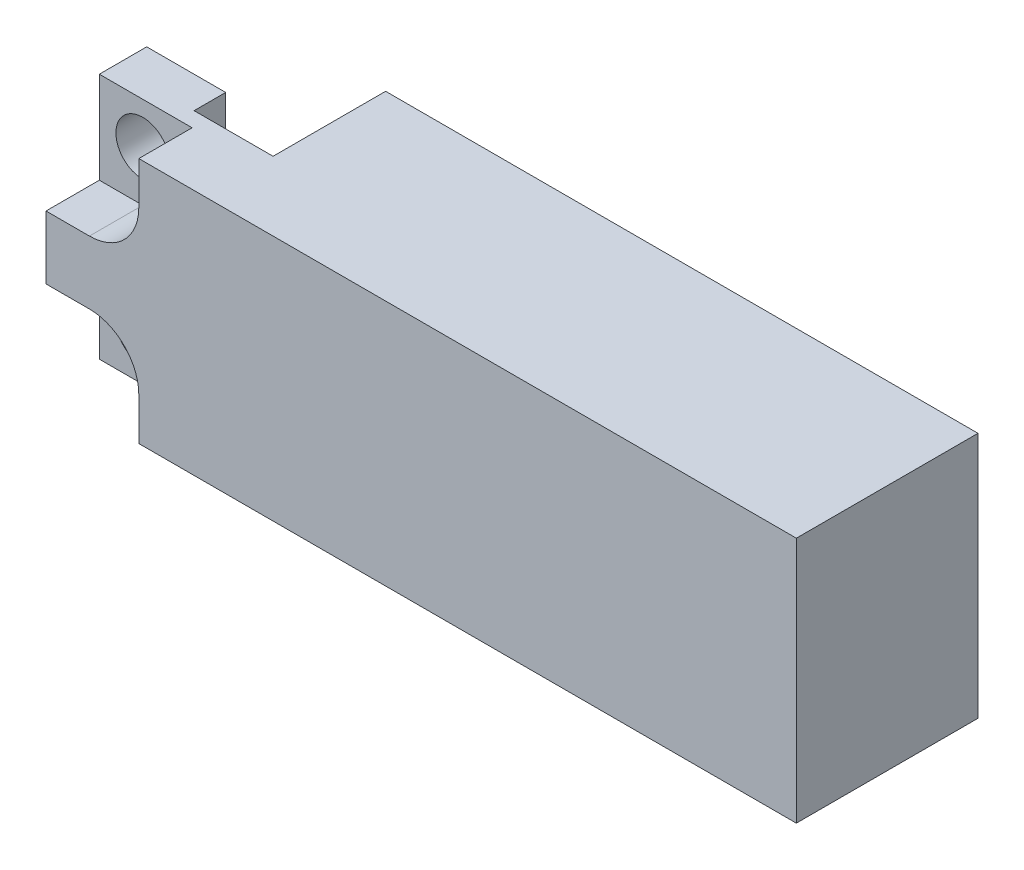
SolidWorks part; units mm, degrees
ref_plane "TOP" through (0, 0, 0) normal (0, 0, 1) x (1, 0, 0)
ref_plane "FRONT" through (0, 0, 0) normal (0, 1, 0) x (1, 0, 0)
ref_plane "RIGHT" through (0, 0, 0) normal (1, 0, 0) x (0, 0, -1)
sketch "Sketch1" plane through (0, 0, 0) normal (0, 1, 0) x (1, 0, 0)
  line L0 (-10.16, 6.477) -> (-10.16, 0)
  line L1 (-10.16, 6.477) -> (-5.08, 6.477)
  line L2 (-5.08, 6.477) -> (-5.08, 4.445)
  line L3 (-5.08, 4.445) -> (0, 4.445)
  line L4 (0, 4.445) -> (0, 11.684)
  line L5 (0, 11.684) -> (38.1, 11.684)
  line L6 (38.1, 11.684) -> (38.1, 0)
  line L7 (-10.16, 0) -> (38.1, 0)
  dimension "D1" = 7.239
  dimension "D2" = 5.08
  dimension "D3" = 5.08
  dimension "D4" = 11.684
  dimension "D5" = 2.032
  dimension "D6" = 38.1
  dimension "D7" = 48.26
extrude "Extrude1" add sketch "Sketch1" along normal mid plane 15.875
sketch "Sketch2" plane through (0, 0, 0) normal (0, 0, 1) x (1, 0, 0)
  line L0 (-10.16, 7.9375) -> (-10.16, -7.9375) construction
  point P0 (-7.366, 5.207)
  dimension "D1" = 2.794
  dimension "D2" = 5.207
hole_wizard "CBORE for #5 Socket Head Cap Screw1" positions "3DSketch1" profile "Sketch3" counterbore size "#5" standard "Ansi Inch"
sketch3d "3DSketch1"
  point P0 (-7.366, 5.207, 0)
sketch "Sketch3" plane through (-7.366, 5.207, 0) normal (1, 0, 0) x (0, -1, 0)
  line L0 (0, 0) -> (0, 11.684)
  line L1 (0, 11.684) -> (1.7272, 11.684)
  line L3 (1.7272, 11.684) -> (1.7272, 3.429)
  line L4 (1.7272, 3.429) -> (3.175, 3.429)
  line L5 (3.175, 3.429) -> (3.175, 0)
  line L7 (3.175, 0) -> (0, 0)
  line L11 (0, -6.35) -> (0, 107.95) construction
  dimension "Thru Hole Dia." = 3.4544
  dimension "Thru Hole Depth" = 11.684
  dimension "C'Bore Dia." = 6.35
  dimension "C'Bore Depth" = 3.429
sketch "Sketch4" plane through (0, 0, 0) normal (0, 0, 1) x (1, 0, 0)
  line L0 (-4.191, 5.207) -> (-4.191, 7.9375)
  line L2 (-5.7458, 7.9375) -> (38.1, 7.9375) construction
  line L3 (-4.191, 7.9375) -> (-10.16, 7.9375)
  line L4 (-10.16, 7.9375) -> (-10.16, 2.032)
  line L5 (-10.16, 3.699) -> (-10.16, -7.9375) construction
  line L6 (-10.16, 2.032) -> (-7.366, 2.032)
  arc A1 (-10.16, 3.699) -> (-5.7458, 7.9375) centre (-7.366, 5.207) ccw construction
  arc A4 (-10.16, 3.699) -> (-5.7458, 7.9375) centre (-7.366, 5.207) ccw construction
  arc A5 (-7.366, 2.032) -> (-4.191, 5.207) centre (-7.366, 5.207) ccw
extrude "Cut-Extrude2" cut sketch "Sketch4" against normal up to surface (3.429 mm away)
mirror "Mirror1" about plane through (0, 0, 0) normal (0, 1, 0) of "Cut-Extrude2", "CBORE for #5 Socket Head Cap Screw1"
